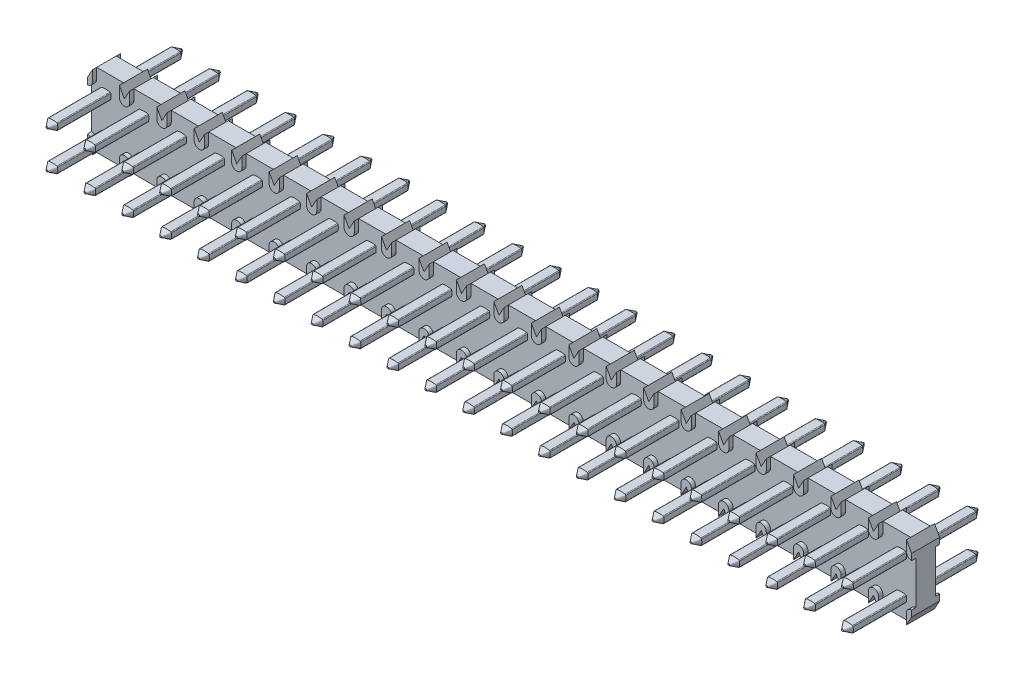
SolidWorks part; units mm, degrees
ref_plane "Front Plane" through (0, 0, 0) normal (0, 0, 1) x (1, 0, 0)
ref_plane "Top Plane" through (0, 0, 0) normal (0, 1, 0) x (1, 0, 0)
ref_plane "Right Plane" through (0, 0, 0) normal (1, 0, 0) x (0, 0, -1)
sketch "Base Outline" plane through (0, 0, 0) normal (0, 0, 1) x (1, 0, 0)
  line L1 (-21.9964, 1.9685) -> (21.9964, 1.9685)
  line L2 (-21.9964, 1.9685) -> (-21.9964, -1.9685)
  line L3 (-21.9964, -1.9685) -> (21.9964, -1.9685)
  line L4 (21.9964, 1.9685) -> (21.9964, -1.9685)
  point P0 (0, 0)
  point P6 (0, -1.9685)
  point P7 (21.9964, 0)
  point P8 (19.9644, -1.9685)
  dimension "D1" = 43.9928
  dimension "D2" = 3.937
  dimension "D3" = 2.032
extrude "Pin Strip Base" add sketch "Base Outline" along normal mid plane 1.0414
sketch "Sketch3" plane through (0, 0, 0) normal (0, 0, 1) x (1, 0, 0)
  line L0 (20.2371, -1.9685) -> (20.2371, -1.4119)
  line L1 (-21.9964, -1.9685) -> (21.9964, -1.9685) construction
  line L2 (19.6917, -1.9685) -> (20.2371, -1.9685)
  line L3 (19.6917, -1.4119) -> (19.6917, -1.9685)
  arc A0 (20.2371, -1.4119) -> (19.6917, -1.4119) centre (19.9644, -1.4119) ccw
  point P6 (20.2371, -1.4119)
  point P8 (19.6917, -1.6902)
  point P9 (19.9644, -1.1392)
extrude "Raised Pin Separator" add sketch "Sketch3" along normal mid plane 1.4986
sketch "Sketch4" plane through (0, 0, 0.7493) normal (0, 0, 1) x (1, 0, 0)
  line L0 (19.6917, -1.9685) -> (20.2371, -1.9685) construction
  line L1 (20.2371, -1.9685) -> (19.9644, -1.4709)
  line L2 (19.9644, -1.4709) -> (19.6917, -1.9685)
  line L3 (19.6917, -1.9685) -> (20.2371, -1.9685)
  point P0 (19.9644, -1.4709)
  point P1 (19.9644, -1.9685)
extrude "Separator Triangle Cut" cut sketch "Sketch4" against normal up to next
pattern_linear "LPattern1" count 21 spacing 1.999 along (-1, 0, 0) of "Raised Pin Separator", "Separator Triangle Cut"
mirror "Pin Separator Mirror1" about plane through (0, 0, 0) normal (0, 1, 0) of "LPattern1", "Raised Pin Separator", "Separator Triangle Cut"
sketch "Sketch6" plane through (0, 0, 0) normal (0, 0, 1) x (1, 0, 0)
  line L0 (21.7237, -1.4119) -> (21.7237, -1.9685)
  line L1 (21.9964, 1.9685) -> (21.9964, -1.9685) construction
  line L2 (21.9964, -1.9685) -> (21.9964, -1.1392)
  line L3 (21.9964, -1.9685) -> (21.7237, -1.9685)
  arc A0 (21.9964, -1.1392) -> (21.7237, -1.4119) centre (21.9964, -1.4119) ccw
  point P2 (21.9964, -1.1392)
  point P3 (21.9964, -1.4119)
extrude "Edge Pin Separator" add sketch "Sketch6" along normal mid plane 1.4986
sketch "Sketch7" plane through (0, 0, 0.7493) normal (0, 0, 1) x (1, 0, 0)
  line L0 (21.9964, -1.9685) -> (21.9964, -1.1392) construction
  line L1 (21.7237, -1.9685) -> (21.9964, -1.9685) construction
  line L2 (21.7237, -1.9685) -> (21.9964, -1.4709)
  line L3 (21.9964, -1.4709) -> (21.9964, -1.9685)
  line L4 (21.9964, -1.9685) -> (21.7237, -1.9685)
  point P0 (21.9964, -1.4709)
extrude "Edge Triange Cut" cut sketch "Sketch7" against normal blind 1.4986
mirror "Edge sep mirror onto nearside edge" about plane through (0, 0, 0) normal (0, 1, 0) of "Edge Triange Cut", "Edge Pin Separator"
mirror "Edge sep mirror onto farside Edge" about plane through (0, 0, 0) normal (1, 0, 0) of "Edge sep mirror onto nearside edge", "Edge Pin Separator", "Edge Triange Cut"
sketch "Sketch8" plane through (0, 0, 0.5207) normal (0, 0, 1) x (1, 0, 0)
  line L0 (-21.9964, 1.1392) -> (-21.9964, -1.1392) construction
  line L1 (-21.4935, 0.9994) -> (-20.9753, 0.9994) construction
  line L2 (-21.4935, 0.8294) -> (-20.9753, 0.8294) construction
  line L3 (-21.4935, 0.8294) -> (-21.4935, 1.1694) construction
  line L4 (-21.4935, 1.1694) -> (-20.9753, 1.1694) construction
  line L5 (-20.9753, 0.8294) -> (-20.9753, 1.1694) construction
  line L6 (-21.2344, 1.1694) -> (-21.2344, 0.8294) construction
  line L7 (21.9964, -1.1392) -> (21.9964, 1.1392) construction
  line L8 (-21.9964, 0) -> (21.9964, 0) construction
  arc A0 (-21.0092, 1.1777) -> (-21.4596, 1.1777) centre (-21.2344, 0.187) ccw
  arc A1 (-21.0092, 0.8211) -> (-21.4596, 0.8211) centre (-21.2344, 1.8118) cw
  arc A2 (-21.4987, 1.135) -> (-21.4987, 0.8639) centre (-20.4918, 0.9994) ccw
  arc A3 (-20.9701, 1.135) -> (-20.9701, 0.8639) centre (-21.977, 0.9994) cw
  arc A4 (-21.4987, 1.135) -> (-21.4596, 1.1777) centre (-21.4484, 1.1282) cw
  arc A5 (-21.4596, 0.8211) -> (-21.4987, 0.8639) centre (-21.4484, 0.8706) cw
  arc A6 (-20.9701, 0.8639) -> (-21.0092, 0.8211) centre (-21.0204, 0.8706) cw
  arc A7 (-20.9701, 1.135) -> (-21.0092, 1.1777) centre (-21.0204, 1.1282) ccw
  arc A8 (-21.4596, -0.8211) -> (-21.4987, -0.8639) centre (-21.4484, -0.8706) ccw
  arc A9 (-21.4987, -1.135) -> (-21.4596, -1.1777) centre (-21.4484, -1.1282) ccw
  arc A10 (-20.9701, -1.135) -> (-21.0092, -1.1777) centre (-21.0204, -1.1282) cw
  arc A11 (-20.9701, -0.8639) -> (-21.0092, -0.8211) centre (-21.0204, -0.8706) ccw
  arc A12 (-20.9701, -1.135) -> (-20.9701, -0.8639) centre (-21.977, -0.9994) ccw
  arc A13 (-21.0092, -0.8211) -> (-21.4596, -0.8211) centre (-21.2344, -1.8118) ccw
  arc A14 (-21.4987, -1.135) -> (-21.4987, -0.8639) centre (-20.4918, -0.9994) cw
  arc A15 (-21.0092, -1.1777) -> (-21.4596, -1.1777) centre (-21.2344, -0.187) cw
  point P0 (-21.2344, -0.9994)
  point P1 (-21.2344, 0.9994)
  point P6 (-21.9964, 0)
  point P9 (-20.9753, 0.9994)
  point P10 (-21.2344, 1.1694)
  point P11 (-21.2344, 1.8118)
  point P12 (-20.4918, 0.9994)
  point P13 (-21.977, 0.9994)
  point P18 (-21.2344, 0.187)
  point P35 (21.9964, 0)
extrude "Socket Connection Pins" add sketch "Sketch8" along normal blind 2.8397
ref_plane "Loft End Plane" through (0, 0, 3.6652) normal (0, 0, 1) x (1, 0, 0)
sketch "Sketch12" plane through (0, 0, 3.6652) normal (0, 0, 1) x (1, 0, 0)
  circle A0 centre (-21.2344, 0.9994) radius 0.05
  point P0 (-21.2344, 0.9994)
sketch "Sketch13" plane through (0, 0, 3.3604) normal (0, 0, 1) x (1, 0, 0)
  arc A8 (-21.0092, 0.8211) -> (-20.9701, 0.8639) centre (-21.0204, 0.8706) ccw
  arc A9 (-20.9701, 0.8639) -> (-20.9701, 1.135) centre (-21.977, 0.9994) ccw
  arc A10 (-20.9701, 1.135) -> (-21.0092, 1.1777) centre (-21.0204, 1.1282) ccw
  arc A11 (-21.0092, 1.1777) -> (-21.4596, 1.1777) centre (-21.2344, 0.187) ccw
  arc A12 (-21.4596, 1.1777) -> (-21.4987, 1.135) centre (-21.4484, 1.1282) ccw
  arc A13 (-21.4987, 1.135) -> (-21.4987, 0.8639) centre (-20.4918, 0.9994) ccw
  arc A14 (-21.4987, 0.8639) -> (-21.4596, 0.8211) centre (-21.4484, 0.8706) ccw
  arc A15 (-21.4596, 0.8211) -> (-21.0092, 0.8211) centre (-21.2344, 1.8118) ccw
  arc A16 (-21.0092, 0.8211) -> (-20.9701, 0.8639) centre (-21.0204, 0.8706) ccw
  arc A17 (-20.9701, 0.8639) -> (-20.9701, 1.135) centre (-21.977, 0.9994) ccw
  arc A18 (-20.9701, 1.135) -> (-21.0092, 1.1777) centre (-21.0204, 1.1282) ccw
  arc A19 (-21.0092, 1.1777) -> (-21.4596, 1.1777) centre (-21.2344, 0.187) ccw
  arc A20 (-21.4596, 1.1777) -> (-21.4987, 1.135) centre (-21.4484, 1.1282) ccw
  arc A21 (-21.4987, 1.135) -> (-21.4987, 0.8639) centre (-20.4918, 0.9994) ccw
  arc A22 (-21.4987, 0.8639) -> (-21.4596, 0.8211) centre (-21.4484, 0.8706) ccw
  arc A23 (-21.4596, 0.8211) -> (-21.0092, 0.8211) centre (-21.2344, 1.8118) ccw
  dimension "D1" = 0
loft "Socket Connection Loft1" add profiles "Sketch12", "Sketch13"
mirror "Loft Mirror1" about plane through (0, 0, 0) normal (0, 1, 0) of "Socket Connection Loft1"
pattern_linear "LPattern2" count 22 spacing 2.0218 along (1, 0, 0) of "Socket Connection Pins", "Socket Connection Loft1", "Loft Mirror1"
sketch "Sketch14" plane through (0, 0, -0.5207) normal (0, 0, -1) x (-1, 0, 0)
  arc A8 (21.4596, 1.1777) -> (21.0092, 1.1777) centre (21.2344, 0.187) ccw
  arc A9 (21.4987, 1.135) -> (21.4596, 1.1777) centre (21.4484, 1.1282) ccw
  arc A10 (21.4987, 0.8639) -> (21.4987, 1.135) centre (20.4918, 0.9994) ccw
  arc A11 (21.4596, 0.8211) -> (21.4987, 0.8639) centre (21.4484, 0.8706) ccw
  arc A12 (21.0092, 0.8211) -> (21.4596, 0.8211) centre (21.2344, 1.8118) ccw
  arc A13 (20.9701, 0.8639) -> (21.0092, 0.8211) centre (21.0204, 0.8706) ccw
  arc A14 (20.9701, 1.135) -> (20.9701, 0.8639) centre (21.977, 0.9994) ccw
  arc A15 (21.0092, 1.1777) -> (20.9701, 1.135) centre (21.0204, 1.1282) ccw
  arc A16 (21.4596, 1.1777) -> (21.0092, 1.1777) centre (21.2344, 0.187) ccw
  arc A17 (21.4987, 1.135) -> (21.4596, 1.1777) centre (21.4484, 1.1282) ccw
  arc A18 (21.4987, 0.8639) -> (21.4987, 1.135) centre (20.4918, 0.9994) ccw
  arc A19 (21.4596, 0.8211) -> (21.4987, 0.8639) centre (21.4484, 0.8706) ccw
  arc A20 (21.0092, 0.8211) -> (21.4596, 0.8211) centre (21.2344, 1.8118) ccw
  arc A21 (20.9701, 0.8639) -> (21.0092, 0.8211) centre (21.0204, 0.8706) ccw
  arc A22 (20.9701, 1.135) -> (20.9701, 0.8639) centre (21.977, 0.9994) ccw
  arc A23 (21.0092, 1.1777) -> (20.9701, 1.135) centre (21.0204, 1.1282) ccw
  arc A24 (21.0092, -1.1777) -> (21.4596, -1.1777) centre (21.2344, -0.187) ccw
  arc A25 (21.4596, -1.1777) -> (21.4987, -1.135) centre (21.4484, -1.1282) ccw
  arc A26 (21.4987, -1.135) -> (21.4987, -0.8639) centre (20.4918, -0.9994) ccw
  arc A27 (21.4987, -0.8639) -> (21.4596, -0.8211) centre (21.4484, -0.8706) ccw
  arc A28 (21.4596, -0.8211) -> (21.0092, -0.8211) centre (21.2344, -1.8118) ccw
  arc A29 (21.0092, -0.8211) -> (20.9701, -0.8639) centre (21.0204, -0.8706) ccw
  arc A30 (20.9701, -0.8639) -> (20.9701, -1.135) centre (21.977, -0.9994) ccw
  arc A31 (20.9701, -1.135) -> (21.0092, -1.1777) centre (21.0204, -1.1282) ccw
  arc A32 (21.0092, -1.1777) -> (21.4596, -1.1777) centre (21.2344, -0.187) ccw
  arc A33 (21.4596, -1.1777) -> (21.4987, -1.135) centre (21.4484, -1.1282) ccw
  arc A34 (21.4987, -1.135) -> (21.4987, -0.8639) centre (20.4918, -0.9994) ccw
  arc A35 (21.4987, -0.8639) -> (21.4596, -0.8211) centre (21.4484, -0.8706) ccw
  arc A36 (21.4596, -0.8211) -> (21.0092, -0.8211) centre (21.2344, -1.8118) ccw
  arc A37 (21.0092, -0.8211) -> (20.9701, -0.8639) centre (21.0204, -0.8706) ccw
  arc A38 (20.9701, -0.8639) -> (20.9701, -1.135) centre (21.977, -0.9994) ccw
  arc A39 (20.9701, -1.135) -> (21.0092, -1.1777) centre (21.0204, -1.1282) ccw
  dimension "D1" = 0
  dimension "D2" = 0
extrude "Board Connection Pins" add sketch "Sketch14" along normal blind 2.6924
ref_plane "Loft End Plane Board Connection" through (0, 0, -3.5179) normal (0, 0, -1) x (-1, 0, 0)
sketch "Sketch15" plane through (0, 0, -3.5179) normal (0, 0, -1) x (-1, 0, 0)
  circle A0 centre (21.2344, 0.9994) radius 0.05 construction
  circle A1 centre (21.2344, 0.9994) radius 0.05
sketch "Sketch16" plane through (0, 0, -3.2131) normal (0, 0, -1) x (-1, 0, 0)
  arc A8 (21.4987, 1.135) -> (21.4596, 1.1777) centre (21.4484, 1.1282) ccw
  arc A9 (21.4596, 1.1777) -> (21.0092, 1.1777) centre (21.2344, 0.187) ccw
  arc A10 (21.0092, 1.1777) -> (20.9701, 1.135) centre (21.0204, 1.1282) ccw
  arc A11 (20.9701, 1.135) -> (20.9701, 0.8639) centre (21.977, 0.9994) ccw
  arc A12 (20.9701, 0.8639) -> (21.0092, 0.8211) centre (21.0204, 0.8706) ccw
  arc A13 (21.0092, 0.8211) -> (21.4596, 0.8211) centre (21.2344, 1.8118) ccw
  arc A14 (21.4596, 0.8211) -> (21.4987, 0.8639) centre (21.4484, 0.8706) ccw
  arc A15 (21.4987, 0.8639) -> (21.4987, 1.135) centre (20.4918, 0.9994) ccw
  arc A16 (21.4987, 1.135) -> (21.4596, 1.1777) centre (21.4484, 1.1282) ccw
  arc A17 (21.4596, 1.1777) -> (21.0092, 1.1777) centre (21.2344, 0.187) ccw
  arc A18 (21.0092, 1.1777) -> (20.9701, 1.135) centre (21.0204, 1.1282) ccw
  arc A19 (20.9701, 1.135) -> (20.9701, 0.8639) centre (21.977, 0.9994) ccw
  arc A20 (20.9701, 0.8639) -> (21.0092, 0.8211) centre (21.0204, 0.8706) ccw
  arc A21 (21.0092, 0.8211) -> (21.4596, 0.8211) centre (21.2344, 1.8118) ccw
  arc A22 (21.4596, 0.8211) -> (21.4987, 0.8639) centre (21.4484, 0.8706) ccw
  arc A23 (21.4987, 0.8639) -> (21.4987, 1.135) centre (20.4918, 0.9994) ccw
  dimension "D1" = 0
loft "Board Connection Loft4" add profiles "Sketch15", "Sketch16"
mirror "Loft Board Connection Mirror" about plane through (0, 0, 0) normal (0, 1, 0) of "Board Connection Loft4"
pattern_linear "Board Connection" count 22 spacing 2.0218 along (1, 0, 0) of "Board Connection Pins", "Board Connection Loft4", "Loft Board Connection Mirror"
ref_plane "Mate Reference Plane" through (0, 0, 0.7493) normal (0, 0, 1) x (1, 0, 0)
ref_plane "Top MR Plane" through (0, 2.032, 0) normal (0, 1, 0) x (-1, 0, 0)
ref_plane "Side MR Plane" through (-22.733, 0, 0) normal (1, 0, 0) x (0, 0, -1)
ref_plane "Header On Board Plane" through (0, 0, -0.7493) normal (0, 0, 1) x (1, 0, 0)
equation "\"D2@Sketch3\" = \"Width_Raised_Groove@Sketch3\"/2"
equation "\"D3@Sketch3\" = \"D2@Sketch3\""
equation "\"D1@Sketch6\" = \"D2@Sketch3\""
equation "\"D1@Sketch7\" = \"D1@Sketch4\""
equation "\"D3@Sketch8\" = \"D2@Sketch8\"/2"
